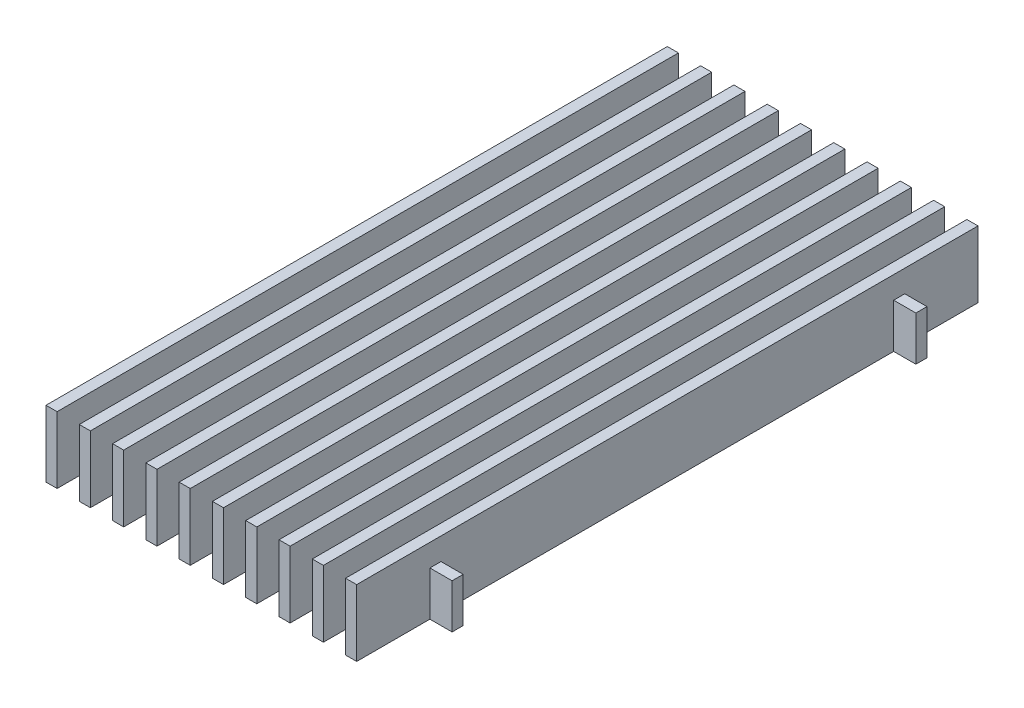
SolidWorks part; units mm, degrees
ref_plane "Front Plane" through (0, 0, 0) normal (0, 0, 1) x (1, 0, 0)
ref_plane "Top Plane" through (0, 0, 0) normal (0, 1, 0) x (1, 0, 0)
ref_plane "Right Plane" through (0, 0, 0) normal (1, 0, 0) x (0, 0, -1)
sketch "Sketch1" plane through (0, 0, 0) normal (0, 0, 1) x (1, 0, 0)
  line L1 (1.5875, -9.525) -> (-1.5875, -9.525)
  line L2 (1.5875, -9.525) -> (1.5875, 9.525)
  line L3 (1.5875, 9.525) -> (-1.5875, 9.525)
  line L4 (-1.5875, -9.525) -> (-1.5875, 9.525)
  line L5 (1.5875, -9.525) -> (-1.5875, 9.525) construction
  line L6 (1.5875, 9.525) -> (-1.5875, -9.525) construction
  point P0 (0, 0)
  dimension "D1" = 3.175
  dimension "D2" = 19.05
extrude "Boss-Extrude1" add sketch "Sketch1" against normal blind 177.8
pattern_linear "LPattern1" count 10 spacing 9.525 along (1, 0, 0)
ref_plane "Plane1" through (42.8625, 0, 0) normal (-1, 0, 0) x (0, 0, 1)
sketch "Sketch2" plane through (42.8625, 0, 0) normal (-1, 0, 0) x (0, 0, 1)
  line L0 (-177.8, -9.525) -> (0, -9.525) construction
  line L1 (-156.845, -9.525) -> (-153.67, -9.525)
  line L2 (-156.845, -9.525) -> (-156.845, 3.175)
  line L3 (-156.845, 3.175) -> (-153.67, 3.175)
  line L4 (-153.67, -9.525) -> (-153.67, 3.175)
  line L5 (-88.9, 9.525) -> (-88.9, -9.525) construction
  line L6 (-177.8, 9.525) -> (0, 9.525) construction
  line L7 (-24.13, -9.525) -> (-24.13, 3.175)
  line L8 (-20.955, 3.175) -> (-24.13, 3.175)
  line L9 (-20.955, -9.525) -> (-20.955, 3.175)
  line L10 (-20.955, -9.525) -> (-24.13, -9.525)
  dimension "D1" = 12.7
  dimension "D2" = 3.175
  dimension "D3" = 64.77
extrude "Boss-Extrude2" add sketch "Sketch2" along normal mid plane 101.6
ref_plane "Plane2" through (0, 0, -88.9) normal (0, 0, 1) x (1, 0, 0)
sketch "Sketch3" plane through (0, -9.525, 0) normal (0, -1, 0) x (1, 0, 0)
  line L0 (-7.9375, -156.845) -> (-7.9375, -153.67) construction
  line L1 (-1.5875, -156.845) -> (-7.9375, -156.845)
  line L2 (-1.5875, -156.845) -> (-1.5875, -163.195)
  line L3 (-1.5875, -163.195) -> (-7.9375, -163.195)
  line L4 (-7.9375, -156.845) -> (-7.9375, -163.195)
  line L5 (-1.5875, -20.955) -> (-1.5875, 0) construction
  line L6 (-7.9375, -20.955) -> (-1.5875, -20.955)
  line L7 (-7.9375, -20.955) -> (-7.9375, -14.605)
  line L8 (-7.9375, -14.605) -> (-1.5875, -14.605)
  line L9 (-1.5875, -20.955) -> (-1.5875, -14.605)
  line L10 (93.6625, -24.13) -> (93.6625, -20.955) construction
  line L11 (87.3125, -20.955) -> (93.6625, -20.955)
  line L12 (87.3125, -20.955) -> (87.3125, -14.605)
  line L13 (87.3125, -14.605) -> (93.6625, -14.605)
  line L14 (93.6625, -20.955) -> (93.6625, -14.605)
  line L15 (87.3125, -156.845) -> (93.6625, -156.845) construction
  line L16 (87.3125, -156.845) -> (93.6625, -156.845)
  line L17 (87.3125, -156.845) -> (87.3125, -163.195)
  line L18 (87.3125, -163.195) -> (93.6625, -163.195)
  line L19 (93.6625, -156.845) -> (93.6625, -163.195)
extrude "Boss-Extrude3" [suppressed] add sketch "Sketch3" against normal blind 3.175 separate body
sketch "Sketch4" [suppressed] plane through (0, -6.35, 0) normal (0, 1, 0) x (1, 0, 0)
  line L0 (-7.9375, 14.605) -> (-1.5875, 20.955) construction
  line L1 (-7.9375, 20.955) -> (-1.5875, 14.605) construction
  line L3 (87.3125, 17.78) -> (90.4875, 17.78) construction
  line L4 (87.3125, 20.955) -> (87.3125, 14.605) construction
  line L5 (90.4875, 17.78) -> (90.4875, 20.955) construction
  line L6 (87.3125, 20.955) -> (93.6625, 20.955) construction
  line L7 (-4.7625, 156.845) -> (-4.7625, 160.02) construction
  line L8 (-1.5875, 156.845) -> (-7.9375, 156.845) construction
  line L9 (-4.7625, 160.02) -> (-1.5875, 160.02) construction
  line L10 (-1.5875, 156.845) -> (-1.5875, 163.195) construction
  line L11 (87.3125, 160.02) -> (90.4875, 160.02) construction
  line L12 (87.3125, 156.845) -> (87.3125, 163.195) construction
  line L13 (90.4875, 160.02) -> (90.4875, 156.845) construction
  line L14 (87.3125, 156.845) -> (93.6625, 156.845) construction
  point P8 (-4.7625, 17.78)
  point P9 (-4.7625, 160.02)
  point P10 (90.4875, 160.02)
  point P11 (90.4875, 17.78)
sketch "Sketch5" [suppressed] plane through (0, -6.35, 0) normal (0, 1, 0) x (1, 0, 0)
ref_plane "Plane3" [suppressed] through (0, 0, -17.78) normal (0, 0, 1) x (1, 0, 0)
sketch "Sketch6" [suppressed] plane through (0, 0, -17.78) normal (0, 0, 1) x (1, 0, 0)
  line L0 (-4.7625, -6.35) -> (-4.7625, -10.033) construction
  line L1 (-3.9687, -7.9375) -> (-3.9687, -10.033) construction
  line L3 (-3.9687, -10.033) -> (-4.7625, -10.033) construction
  line L4 (-3.9687, -7.9375) -> (-3.3049, -6.689) construction
  line L9 (-4.054, -7.9375) -> (-3.2147, -6.35)
  line L10 (-3.2147, -6.35) -> (-4.7625, -6.35)
  line L11 (-4.054, -7.9375) -> (-4.054, -13.1517)
  line L15 (-4.054, -13.1517) -> (-4.7625, -12.7771)
  line L16 (-4.7625, -6.35) -> (-4.7625, -13.7969)
  ellipse E5 centre (-4.9963, -13.0477) end of major axis (-4.0572, -13.1793) minor radius 0.7586 (-4.7625, -13.7969) -> (-4.054, -13.1517) ccw
revolve "Cut-Revolve1" [suppressed] cut sketch "Sketch6" angle 360 about L0
sketch "Sketch7" [suppressed] plane through (0, -6.35, 0) normal (0, 1, 0) x (1, 0, 0)
  point P0 (90.4875, 17.78)
  point P2 (-4.7625, 160.02)
  point P4 (90.4875, 160.02)
pattern_sketch "Sketch-Pattern1" [suppressed]
